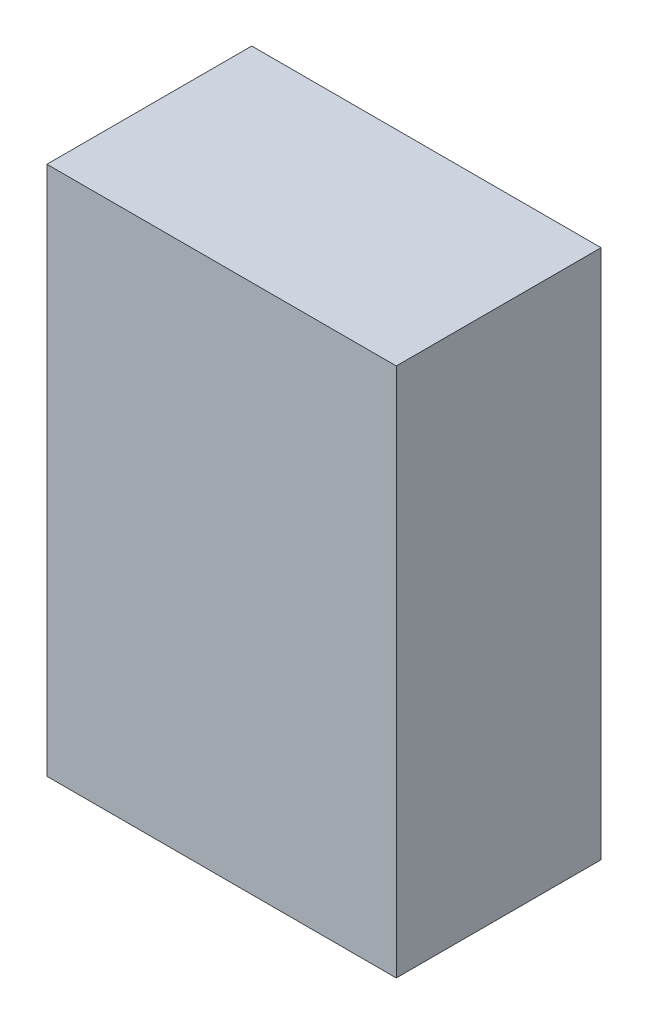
SolidWorks part; units mm, degrees
ref_plane "Front Plane" through (0, 0, 0) normal (0, 0, 1) x (1, 0, 0)
ref_plane "Top Plane" through (0, 0, 0) normal (0, 1, 0) x (1, 0, 0)
ref_plane "Right Plane" through (0, 0, 0) normal (1, 0, 0) x (0, 0, -1)
sketch "Sketch1" plane through (0, 0, 0) normal (0, 0, 1) x (1, 0, 0)
  line L1 (0, 0) -> (58, 0)
  line L2 (0, 0) -> (0, 88)
  line L3 (0, 88) -> (58, 88)
  line L4 (58, 0) -> (58, 88)
  dimension "D1" = 88
  dimension "D2" = 58
extrude "Boss-Extrude1" add sketch "Sketch1" along normal blind 34
